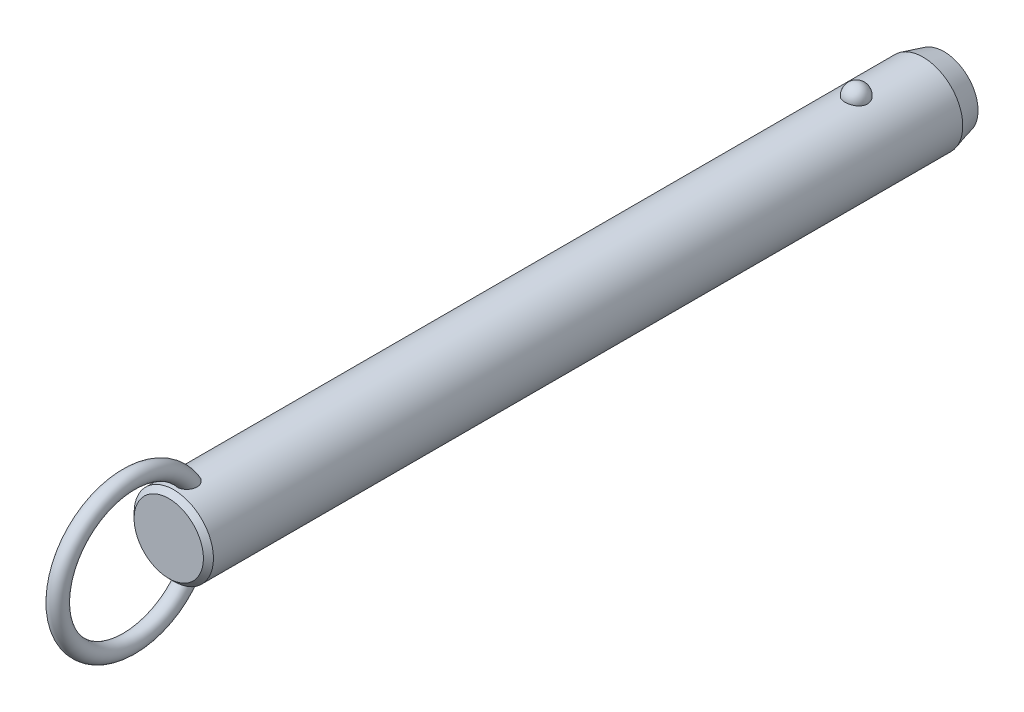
SolidWorks part; units mm, degrees
ref_plane "Front Plane" through (0, 0, 0) normal (0, 0, 1) x (1, 0, 0)
ref_plane "Top Plane" through (0, 0, 0) normal (0, 1, 0) x (1, 0, 0)
ref_plane "Right Plane" through (0, 0, 0) normal (1, 0, 0) x (0, 0, -1)
sketch "Sketch2" plane through (0, 0, 0) normal (0, 0, 1) x (1, 0, 0)
  circle A0 centre (0, 0) radius 9.5
  point P3 (0, 9.5)
  dimension "D1" = 19
extrude "Boss-Extrude1" add sketch "Sketch2" along normal blind 152.4
sketch "Sketch3" plane through (0, 0, 0) normal (0, 0, -1) x (-1, 0, 0)
  circle A0 centre (0, 0) radius 9.5
  dimension "D1" = 19
extrude "Boss-Extrude2" add sketch "Sketch3" along normal blind 23.7
chamfer "Chamfer1" distance 5 angle 15 1 edges at (-9.5, 0, -23.7)
sketch "Sketch12" plane through (0, 0, 0) normal (1, 0, 0) x (0, 0, -1)
  line L0 (-152.4, 9.5) -> (-152.4, -9.5) construction
  point P0 (-152.4, 0)
sketch "Sketch13" plane through (0, 0, 0) normal (1, 0, 0) x (0, 0, -1)
  circle A0 centre (-171.45, 0) radius 19.05
  point P2 (-152.4, 0)
  dimension "D1" = 38.1
sketch "Sketch14" plane through (0, 0, 0) normal (0, 1, 0) x (1, 0, 0)
  circle A0 centre (0, -154.4) radius 2
  point P2 (0, -152.4)
  dimension "D1" = 4
sweep "Sweep1" add profiles "Sketch14" path "Sketch13"
sketch "Sketch15" plane through (0, 0, 152.4) normal (0, 0, 1) x (1, 0, 0)
  circle A0 centre (0, 0) radius 9.5
  dimension "D1" = 19
extrude "Boss-Extrude3" add sketch "Sketch15" along normal blind 9.52
chamfer "Chamfer2" distance 1.2 angle 45 1 edges at (9.5, 0, 161.92)
sketch "Sketch18" plane through (0, 0, 0) normal (1, 0, 0) x (0, 0, -1)
  line L0 (18.7, 9.5) -> (-154.9378, 9.5) construction
  line L1 (2.7, 12.2) -> (2.7, 6.8)
  line L2 (-154.9378, -9.5) -> (18.7, -9.5) construction
  arc A0 (2.7, 12.2) -> (2.7, 6.8) centre (2.7, 9.5) ccw
  point P4 (0, 9.5)
  dimension "D1" = 21.7
revolve "Revolve1" add sketch "Sketch18" angle 360 about L1
